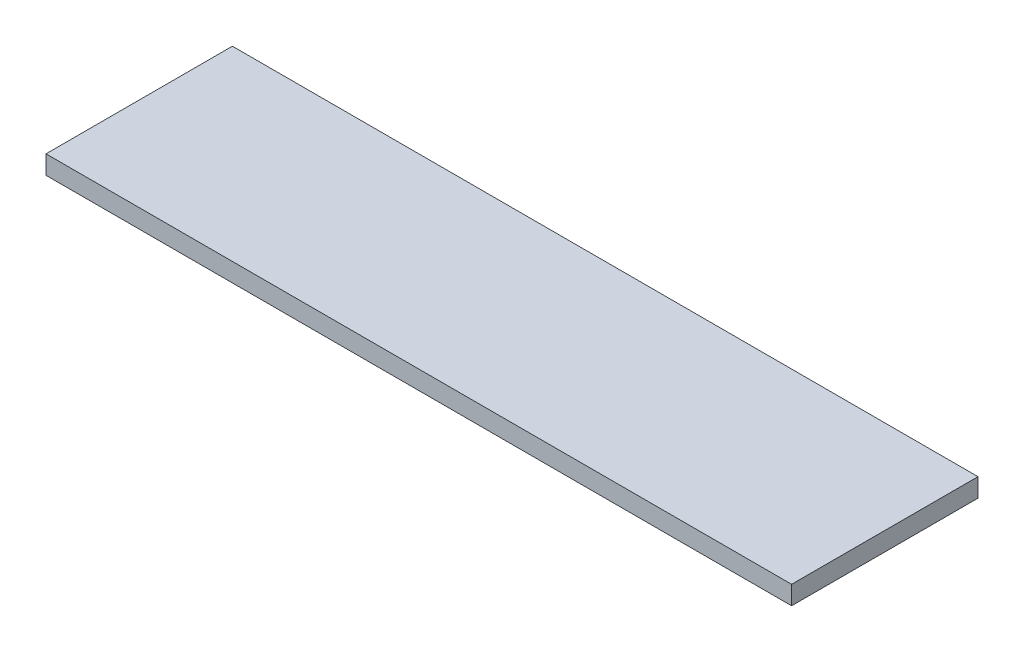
SolidWorks part; units mm, degrees
ref_plane "Front Plane" through (0, 0, 0) normal (0, 0, 1) x (1, 0, 0)
ref_plane "Top Plane" through (0, 0, 0) normal (0, 1, 0) x (1, 0, 0)
ref_plane "Right Plane" through (0, 0, 0) normal (1, 0, 0) x (0, 0, -1)
sketch "Sketch1" plane through (0, 0, 0) normal (0, 1, 0) x (1, 0, 0)
  line L1 (0, 0) -> (203.2, 0)
  line L2 (0, 0) -> (0, 50.8)
  line L3 (0, 50.8) -> (203.2, 50.8)
  line L4 (203.2, 0) -> (203.2, 50.8)
  dimension "D1" = 50.8
  dimension "D2" = 203.2
extrude "Extrude1" add sketch "Sketch1" along normal blind 5.08
